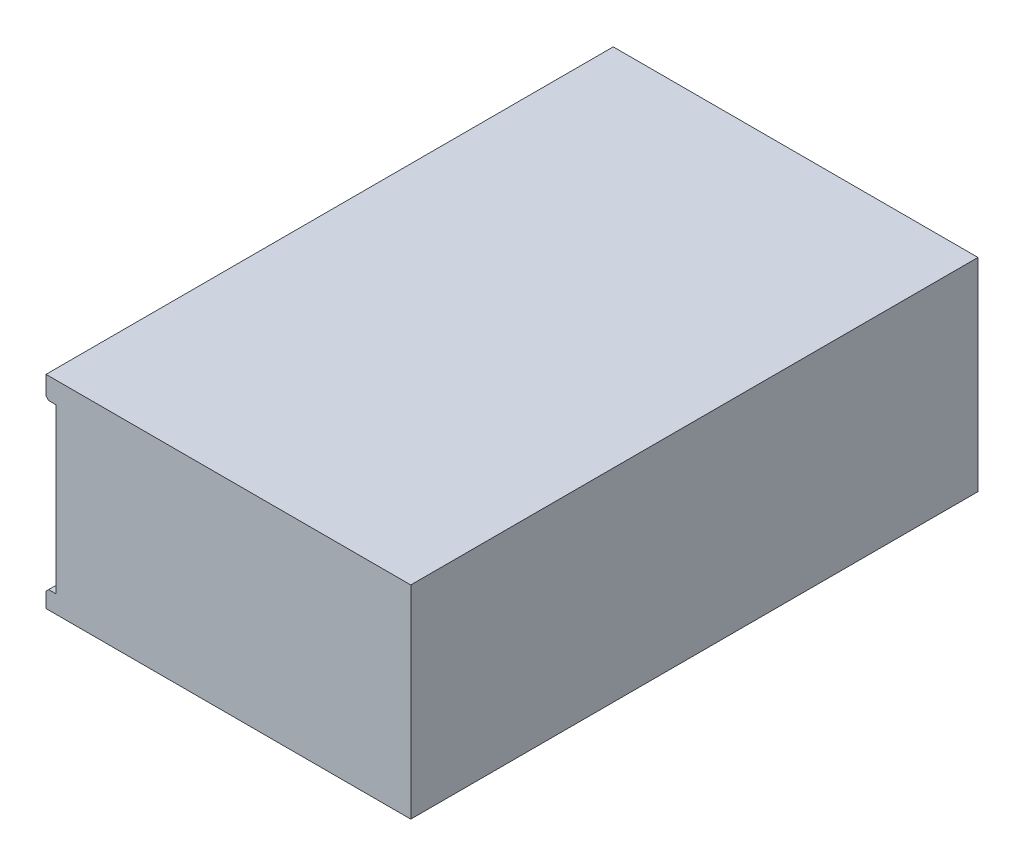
SolidWorks part; units mm, degrees
ref_plane "FRONT" through (0, 0, 0) normal (0, 0, 1) x (1, 0, 0)
ref_plane "TOP" through (0, 0, 0) normal (0, 1, 0) x (1, 0, 0)
ref_plane "RIGHT" through (0, 0, 0) normal (1, 0, 0) x (0, 0, -1)
sketch "Sketch1" plane through (0, 0, 0) normal (0, 0, 1) x (1, 0, 0)
  line L0 (50.673, 0) -> (50.673, -28.956)
  line L1 (50.673, -28.956) -> (-1.397, -28.956)
  line L2 (-1.397, -28.956) -> (-1.397, -26.416)
  line L3 (-1.397, -26.416) -> (0, -26.416)
  line L4 (0, -26.416) -> (0, -3.048)
  line L5 (0, -3.048) -> (-1.397, -3.048)
  line L6 (-1.397, -3.048) -> (-1.397, 0)
  line L7 (-1.397, 0) -> (50.673, 0)
  dimension "D1" = 52.07
  dimension "D2" = 50.673
  dimension "D3" = 3.048
  dimension "D4" = 2.54
  dimension "D5" = 28.956
extrude "Extrude1" add sketch "Sketch1" along normal mid plane 80.9752
sketch "Sketch2" plane through (0, 0, 0) normal (-1, 0, 0) x (0, 0, 1)
  line L0 (0, 0) -> (0, -28.956) construction
  line L1 (40.4876, -28.956) -> (-40.4876, -28.956) construction
  line L2 (0, -14.478) -> (44.6305, -14.478) construction
  point P0 (-35.179, -6.35)
  point P1 (35.179, -6.35)
  point P9 (-35.179, -23.114)
  point P15 (35.179, -23.114)
  dimension "D1" = 35.179
  dimension "D2" = 35.179
  dimension "D3" = 8.128
  dimension "D4" = 8.636
hole_wizard "#10-32 Tapped Hole1" positions "3DSketch1" profile "Sketch3" tap size "#10-32" standard "Ansi Inch"
sketch3d "3DSketch1"
  point P0 (0, -6.35, -35.179)
  point P3 (0, -6.35, 35.179)
  point P6 (0, -23.114, -35.179)
  point P9 (0, -23.114, 35.179)
sketch "Sketch3" plane through (0, -6.35, -35.179) normal (0, 1, 0) x (0, 0, 1)
  line L0 (0, 0) -> (0, 11.2108)
  line L1 (0, 11.2108) -> (2.0193, 9.9974)
  line L2 (2.0193, 9.9974) -> (2.0193, 7.62)
  line L3 (2.0193, 7.62) -> (2.413, 7.62)
  line L4 (2.413, 7.62) -> (2.413, 0)
  line L5 (2.413, 0) -> (0, 0)
  line L10 (0, 11.2108) -> (-2.0193, 9.9974) construction
  line L11 (0, -6.35) -> (0, 107.95) construction
  dimension "Tap Drill Dia." = 4.0386
  dimension "Tap Drill Depth" = 9.9974
  dimension "Thread Major Dia." = 4.826
  dimension "Thread Depth" = 7.62
  dimension "Drill Angle" = 118
chamfer "Chamfer1" distance 0.381 angle 45 2 edges at (-1.397, -26.416, 0) (-1.397, -3.048, 0)
